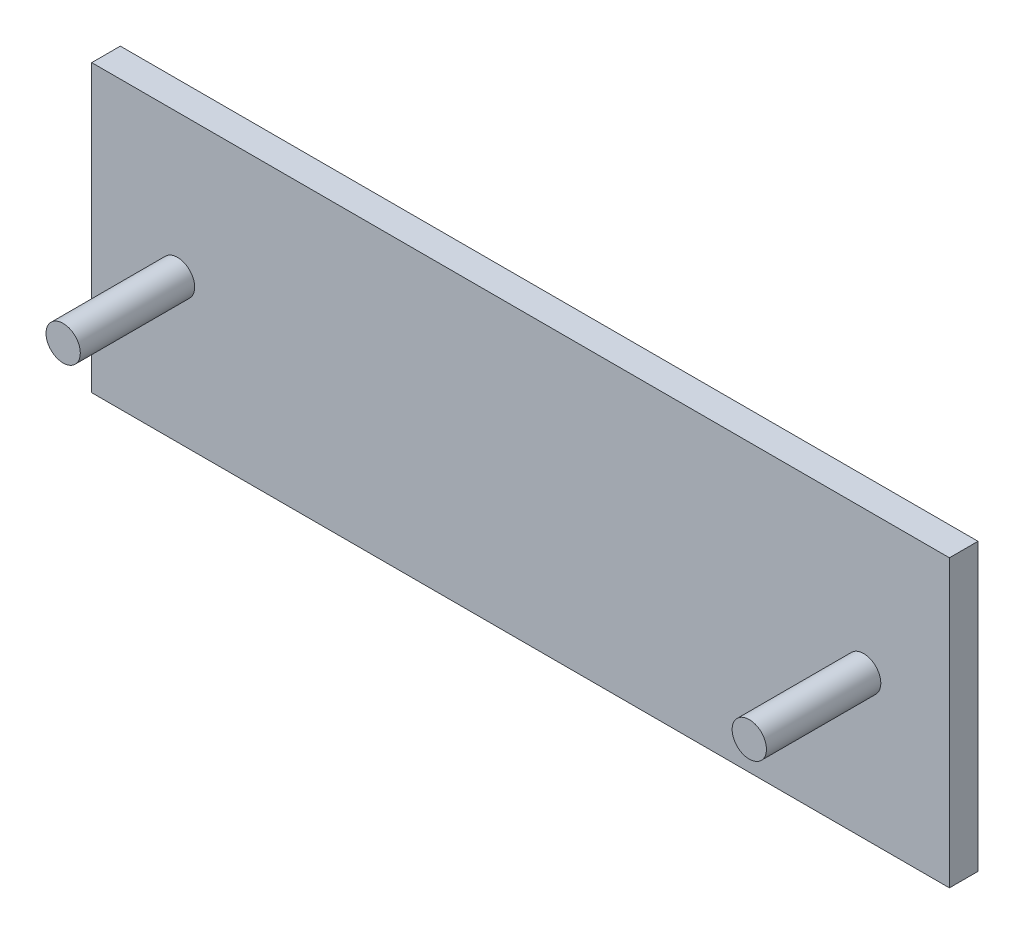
SolidWorks part; units mm, degrees
ref_plane "Ebene vorne" through (0, 0, 0) normal (0, 0, 1) x (1, 0, 0)
ref_plane "Ebene oben" through (0, 0, 0) normal (0, 1, 0) x (1, 0, 0)
ref_plane "Ebene rechts" through (0, 0, 0) normal (1, 0, 0) x (0, 0, -1)
sketch "Skizze1" plane through (0, 0, 0) normal (0, 0, 1) x (1, 0, 0)
  line L0 (0, 0) -> (300, 0)
  line L1 (300, 0) -> (300, 100)
  line L2 (300, 100) -> (0, 100)
  line L3 (0, 100) -> (0, 0)
extrude "Linear austragen1" add sketch "Skizze1" along normal blind 10
sketch "Skizze2" plane through (0, 0, 10) normal (0, 0, 1) x (1, 0, 0)
  line L0 (0, 0) -> (300, 0) construction
  line L1 (0, 100) -> (0, 0) construction
  circle A0 centre (30, 50) radius 6
  dimension "D1" = 50
  dimension "D2" = 30
extrude "Linear austragen2" add sketch "Skizze2" along normal blind 40
sketch "Skizze3" plane through (0, 0, 10) normal (0, 0, 1) x (1, 0, 0)
  circle A0 centre (270, 50) radius 6
extrude "Linear austragen3" add sketch "Skizze3" along normal blind 40
